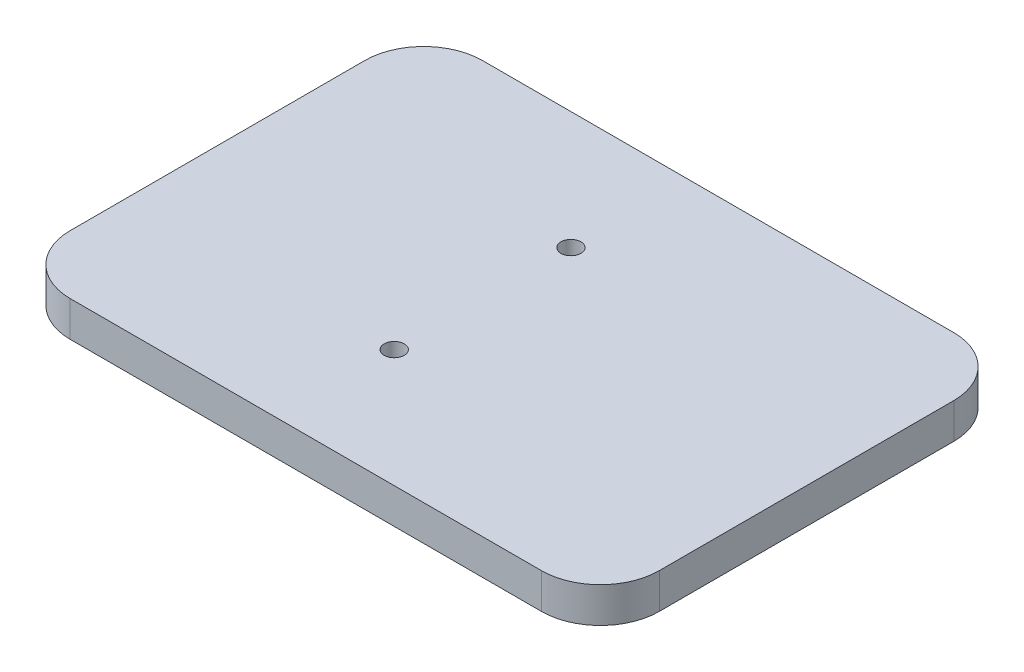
SolidWorks part; units mm, degrees
ref_plane "Front Plane" through (0, 0, 0) normal (0, 0, 1) x (1, 0, 0)
ref_plane "Top Plane" through (0, 0, 0) normal (0, 1, 0) x (1, 0, 0)
ref_plane "Right Plane" through (0, 0, 0) normal (1, 0, 0) x (0, 0, -1)
sketch "Sketch1" plane through (0, 0, 0) normal (0, 1, 0) x (1, 0, 0)
  line L1 (0, 0) -> (100, 0)
  line L2 (0, 0) -> (0, 70)
  line L3 (0, 70) -> (100, 70)
  line L4 (100, 0) -> (100, 70)
  dimension "D1" = 70
  dimension "D2" = 100
extrude "Extrude1" add sketch "Sketch1" along normal blind 6
sketch "Sketch2" plane through (0, 0, 0) normal (0, -1, 0) x (1, 0, 0)
  line L0 (45, 0) -> (45, -70) construction
  line L1 (0, 0) -> (100, 0) construction
  line L2 (100, -70) -> (0, -70) construction
  line L3 (0, -35) -> (100, -35) construction
  line L4 (0, -70) -> (0, 0) construction
  line L5 (100, 0) -> (100, -70) construction
  point P6 (45, -20)
  point P7 (45, -50)
  dimension "D1" = 15
  dimension "D2" = 15
  dimension "D3" = 55
hole_wizard "CBORE for M3 Hex Socket Head Cap Screw1" positions "3DSketch1" profile "Sketch3" counterbore size "M3" standard "ISO"
sketch3d "3DSketch1"
  point P0 (45, 0, -20)
  point P3 (45, 0, -50)
sketch "Sketch3" plane through (45, 0, -20) normal (1, 0, 0) x (0, 0, -1)
  line L0 (0, 0) -> (0, 6)
  line L1 (0, 6) -> (1.7, 6)
  line L3 (1.7, 6) -> (1.7, 3)
  line L4 (1.7, 3) -> (3.25, 3)
  line L5 (3.25, 3) -> (3.25, 0)
  line L7 (3.25, 0) -> (0, 0)
  line L11 (0, -6.35) -> (0, 107.95) construction
  dimension "Thru Hole Dia." = 3.4
  dimension "Thru Hole Depth" = 6
  dimension "C'Bore Dia." = 6.5
  dimension "C'Bore Depth" = 3
fillet "Fillet1" radius 10 4 edges at (0, 3, 0) (0, 3, -70) (100, 3, -70) (100, 3, 0)
